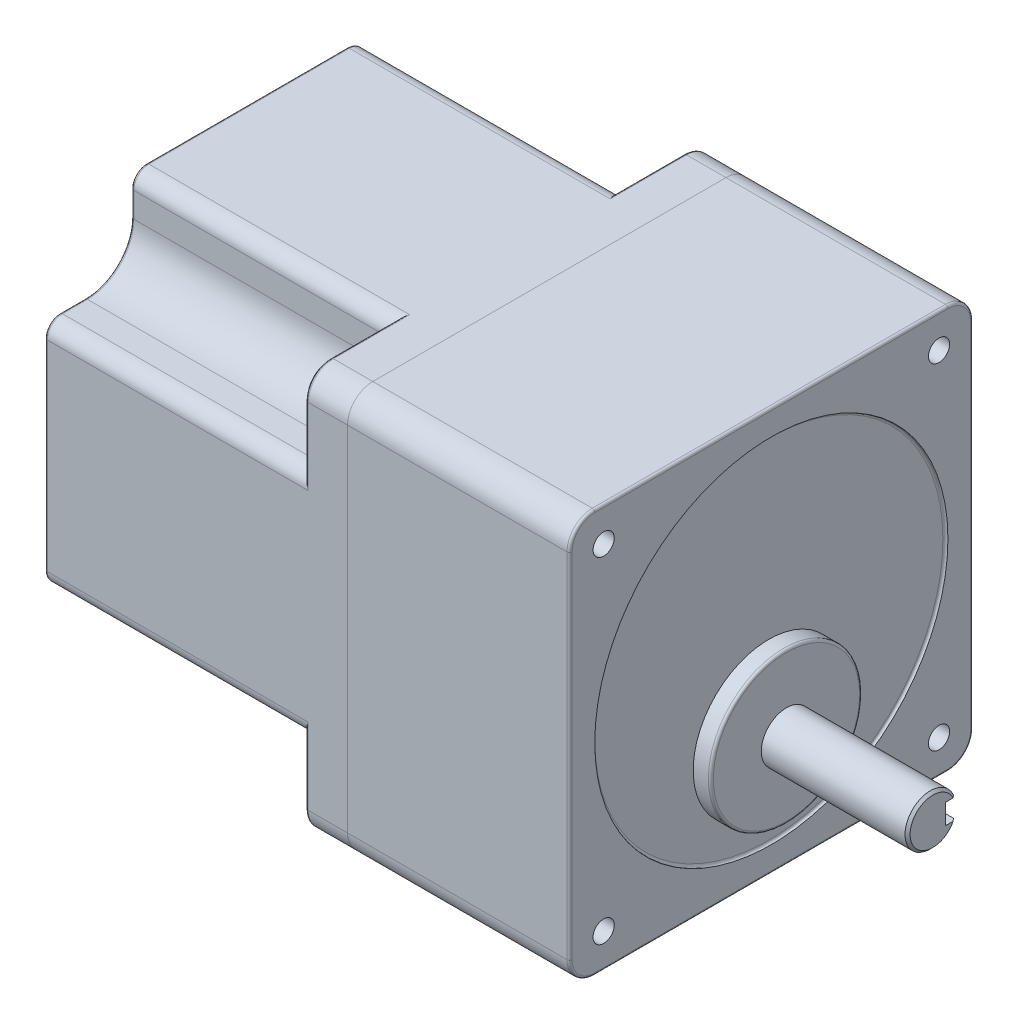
SolidWorks part; units mm, degrees
ref_plane "前视基准面" through (0, 0, 0) normal (0, 0, 1) x (1, 0, 0)
ref_plane "上视基准面" through (0, 0, 0) normal (0, 1, 0) x (1, 0, 0)
ref_plane "右视基准面" through (0, 0, 0) normal (1, 0, 0) x (0, 0, -1)
sketch "草图1" plane through (0, 0, 0) normal (1, 0, 0) x (0, 0, -1)
  line L1 (-35, -40) -> (35, -40)
  line L2 (-40, -35) -> (-40, 35)
  line L3 (-35, 40) -> (35, 40)
  line L4 (40, -35) -> (40, 35)
  line L5 (-40, -40) -> (40, 40) construction
  line L6 (-40, 40) -> (40, -40) construction
  arc A0 (35, 40) -> (40, 35) centre (35, 35) cw
  arc A1 (35, -40) -> (40, -35) centre (35, -35) ccw
  arc A2 (-35, -40) -> (-40, -35) centre (-35, -35) cw
  arc A3 (-40, 35) -> (-35, 40) centre (-35, 35) cw
  point P0 (0, 0)
  dimension "D1" = 5
extrude "凸台-拉伸1" add sketch "草图1" against normal blind 44
sketch "草图2" plane through (-44, 0, 0) normal (-1, 0, 0) x (0, 0, 1)
  line L0 (-35, 40) -> (35, 40) construction
  line L1 (-35, -40) -> (35, -40)
  line L2 (-40, -35) -> (-40, 35)
  line L3 (-35, 40) -> (35, 40)
  line L4 (40, -35) -> (40, 35)
  line L5 (-40, -40) -> (40, 40) construction
  line L6 (-40, 40) -> (40, -40) construction
  arc A0 (35, 40) -> (40, 35) centre (35, 35) cw
  arc A1 (35, -40) -> (40, -35) centre (35, -35) ccw
  arc A2 (-35, -40) -> (-40, -35) centre (-35, -35) cw
  arc A3 (-40, 35) -> (-35, 40) centre (-35, 35) cw
  point P0 (0, 0)
  dimension "D1" = 5
extrude "凸台-拉伸2" add sketch "草图2" along normal blind 60 separate body
sketch "草图3" plane through (-104, 0, 0) normal (-1, 0, 0) x (0, 0, 1)
  line L0 (-32.0461, 22.8686) -> (-37, 22.8686)
  line L1 (-40, 35) -> (-40, -35) construction
  line L3 (-32.0461, -22.8686) -> (-37, -22.8686)
  line L5 (-22.8686, -32.0461) -> (-22.8686, -37)
  line L6 (-35, -40) -> (35, -40) construction
  line L8 (22.8686, -32.0461) -> (22.8686, -37)
  line L10 (32.0461, -22.8686) -> (37, -22.8686)
  line L11 (40, -35) -> (40, 35) construction
  line L12 (-40, 19.8686) -> (-40, 35)
  line L13 (32.0461, 22.8686) -> (37, 22.8686)
  line L14 (-35, 40) -> (-19.8686, 40)
  line L15 (22.8686, 32.0461) -> (22.8686, 37)
  line L16 (35, 40) -> (-35, 40) construction
  line L17 (19.8686, 40) -> (35, 40)
  line L18 (-22.8686, 32.0461) -> (-22.8686, 37)
  line L19 (40, 35) -> (40, 19.8686)
  line L20 (40, -19.8686) -> (40, -35)
  line L21 (35, -40) -> (19.8686, -40)
  line L22 (-19.8686, -40) -> (-35, -40)
  line L23 (-40, -35) -> (-40, -19.8686)
  arc A0 (22.8686, 37) -> (19.8686, 40) centre (19.8686, 37) ccw
  arc A1 (37, 22.8686) -> (40, 19.8686) centre (37, 19.8686) cw
  arc A2 (37, -22.8686) -> (40, -19.8686) centre (37, -19.8686) ccw
  arc A3 (22.8686, -37) -> (19.8686, -40) centre (19.8686, -37) cw
  arc A4 (-22.8686, -32.0461) -> (-32.0461, -22.8686) centre (-32.0461, -32.0461) ccw
  arc A5 (32.0461, -22.8686) -> (22.8686, -32.0461) centre (32.0461, -32.0461) ccw
  arc A6 (22.8686, 32.0461) -> (32.0461, 22.8686) centre (32.0461, 32.0461) ccw
  arc A7 (-32.0461, 22.8686) -> (-22.8686, 32.0461) centre (-32.0461, 32.0461) ccw
  arc A8 (-40, -35) -> (-35, -40) centre (-35, -35) ccw
  arc A9 (-35, 40) -> (-40, 35) centre (-35, 35) ccw
  arc A10 (40, 35) -> (35, 40) centre (35, 35) ccw
  arc A11 (35, -40) -> (40, -35) centre (35, -35) ccw
  arc A12 (-22.8686, -37) -> (-19.8686, -40) centre (-19.8686, -37) ccw
  arc A13 (-37, -22.8686) -> (-40, -19.8686) centre (-37, -19.8686) cw
  arc A14 (-37, 22.8686) -> (-40, 19.8686) centre (-37, 19.8686) ccw
  arc A15 (-22.8686, 37) -> (-19.8686, 40) centre (-19.8686, 37) cw
  point P2 (0, 0)
  point P35 (22.8686, 40)
  point P54 (40, 22.8686)
  point P57 (40, -22.8686)
  point P60 (22.8686, -40)
  point P63 (-22.8686, -40)
  point P66 (-40, -22.8686)
  point P69 (-40, 22.8686)
  point P72 (-22.8686, 40)
  dimension "D1" = 3
extrude "切除-拉伸2" cut sketch "草图3" against normal blind 51.7
sketch "草图4" plane through (0, 0, 0) normal (1, 0, 0) x (0, 0, -1)
  circle A0 centre (0, 0) radius 35
extrude "切除-拉伸3" cut sketch "草图4" against normal blind 0.5
fillet "圆角1" radius 0.5 1 edges at (-0.5, 0, -35)
sketch "草图5" plane through (-0.5, 0, 0) normal (1, 0, 0) x (0, 0, -1)
  circle A0 centre (0, -15) radius 15
extrude "凸台-拉伸3" add sketch "草图5" along normal blind 3.5
fillet "圆角2" radius 0.5 1 edges at (3, -15, -15)
fillet "圆角3" radius 0.5 8 edges at (0, -38.5355, 38.5355) (0, -40, 0) (0, -38.5355, -38.5355) (0, 38.5355, -38.5355) (0, 40, 0) (0, 38.5355, 38.5355) (0, 0, 40) (0, 0, -40)
fillet "圆角4" radius 0.5 24 edges at (-104, 25.5566, 25.5566) (-104, 22.8686, 34.523) (-104, 21.9899, 39.1213) (-104, 0, 40) (-104, -21.9899, 39.1213) (-104, -22.8686, 34.523) (-104, -25.5566, 25.5566) (-104, -34.523, 22.8686) (-104, -39.1213, 21.9899) (-104, -40, 0) (-104, -39.1213, -21.9899) (-104, -34.523, -22.8686) (-104, -25.5566, -25.5566) (-104, -22.8686, -34.523) (-104, -21.9899, -39.1213) (-104, 0, -40) (-104, 21.9899, -39.1213) (-104, 22.8686, -34.523) (-104, 25.5566, -25.5566) (-104, 34.523, -22.8686) (-104, 39.1213, -21.9899) (-104, 40, 0) (-104, 39.1213, 21.9899) (-104, 34.523, 22.8686)
sketch "草图6" plane through (3, 0, 0) normal (1, 0, 0) x (0, 0, -1)
  circle A0 centre (0, -15) radius 5
extrude "凸台-拉伸4" add sketch "草图6" along normal blind 29
ref_plane "基准面1" through (0, 0, -5) normal (0, 0, 1) x (1, 0, 0)
sketch "草图7" plane through (0, 0, -5) normal (0, 0, 1) x (1, 0, 0)
  line L1 (32, -20) -> (32, -10) construction
  line L2 (32, -13) -> (9, -13)
  line L3 (32, -13) -> (32, -17)
  line L4 (32, -17) -> (9, -17)
  arc A0 (9, -13) -> (9, -17) centre (9, -15) ccw
extrude "切除-拉伸5" cut sketch "草图7" along normal blind 2.5
chamfer "倒角1" distance 0.5 angle 45 1 edges at (32, -15, 5)
sketch "草图9" plane through (0, 0, 0) normal (1, 0, 0) x (0, 0, -1)
  point P19 (-33.234, 33.234)
  point P20 (33.234, 33.234)
  point P21 (33.234, -33.234)
  point P22 (-33.234, -33.234)
hole_wizard "M5 螺纹孔1" positions "3D草图1" profile "草图10" tap size "M5" standard "GB"
sketch3d "3D草图1"
  point P0 (0, 33.234, 33.234)
  point P3 (0, 33.234, -33.234)
  point P6 (0, -33.234, -33.234)
  point P9 (0, -33.234, 33.234)
sketch "草图10" plane through (0, 33.234, 33.234) normal (0, 1, 0) x (0, 0, -1)
  line L0 (0, 0) -> (0, 15.2618)
  line L1 (0, 15.2618) -> (2.1, 14)
  line L2 (2.1, 14) -> (2.1, 0)
  line L5 (2.1, 0) -> (0, 0)
  line L10 (0, 15.2618) -> (-2.1, 14) construction
  line L11 (0, -6.35) -> (0, 107.95) construction
  dimension "螺纹孔钻头直径" = 4.2
  dimension "螺纹孔钻头深度" = 14
  dimension "导头角度" = 118
sketch "草图11" plane through (-52.3, 0, 0) normal (-1, 0, 0) x (0, 0, 1)
  circle A0 centre (-32.0461, 32.0461) radius 4
  circle A1 centre (32.0461, 32.0461) radius 4
  circle A2 centre (32.0461, -32.0461) radius 4
  circle A3 centre (-32.0461, -32.0461) radius 4
extrude "凸台-拉伸5" add sketch "草图11" along normal blind 3.5 separate body
sketch "草图12" plane through (-55.8, 0, 0) normal (-1, 0, 0) x (0, 0, 1)
  line L1 (-30.7774, 34.2778) -> (-33.3444, 34.2607)
  line L2 (-33.3444, 34.2607) -> (-34.6132, 32.029)
  line L3 (-34.6132, 32.029) -> (-33.3148, 29.8144)
  line L4 (-33.3148, 29.8144) -> (-30.7477, 29.8315)
  line L5 (-30.7477, 29.8315) -> (-29.479, 32.0632)
  line L6 (-29.479, 32.0632) -> (-30.7774, 34.2778)
  line L7 (33.2714, 34.2778) -> (30.726, 34.2231)
  line L8 (30.726, 34.2231) -> (29.5007, 31.9914)
  line L9 (29.5007, 31.9914) -> (30.8208, 29.8144)
  line L10 (30.8208, 29.8144) -> (33.3661, 29.8691)
  line L11 (33.3661, 29.8691) -> (34.5915, 32.1008)
  line L12 (34.5915, 32.1008) -> (33.2714, 34.2778)
  line L13 (-30.7477, -29.7159) -> (-33.4149, -29.7566)
  line L14 (-33.4149, -29.7566) -> (-34.7132, -32.0868)
  line L15 (-34.7132, -32.0868) -> (-33.3444, -34.3762)
  line L16 (-33.3444, -34.3762) -> (-30.6773, -34.3356)
  line L17 (-30.6773, -34.3356) -> (-29.379, -32.0054)
  line L18 (-29.379, -32.0054) -> (-30.7477, -29.7159)
  line L19 (30.6027, -34.5461) -> (33.4895, -34.5461)
  line L20 (33.4895, -34.5461) -> (34.9328, -32.0461)
  line L21 (34.9328, -32.0461) -> (33.4895, -29.5461)
  line L22 (33.4895, -29.5461) -> (30.6027, -29.5461)
  line L23 (30.6027, -29.5461) -> (29.1593, -32.0461)
  line L24 (29.1593, -32.0461) -> (30.6027, -34.5461)
  circle A0 centre (-32.0461, 32.0461) radius 2.2232 construction
  circle A1 centre (32.0461, 32.0461) radius 2.2049 construction
  circle A2 centre (-32.0461, -32.0461) radius 2.3101 construction
  circle A3 centre (32.0461, -32.0461) radius 2.5 construction
extrude "切除-拉伸6" cut sketch "草图12" against normal blind 1.5
chamfer "倒角2" distance 0.3 angle 45 6 edges at (-55.8, 30.9217, -33.964) (-55.8, 29.8229, -32.0313) (-55.8, 30.9473, -30.1134) (-55.8, 33.1705, -30.1282) (-55.8, 33.1448, -33.9788) (-55.8, 34.2692, -32.0609)
chamfer "倒角3" distance 0.3 angle 45 6 edges at (-55.8, 33.1893, 33.9314) (-55.8, 30.9849, 33.9788) (-55.8, 29.8417, 32.0934) (-55.8, 30.9029, 30.1607) (-55.8, 33.1072, 30.1134) (-55.8, 34.2504, 31.9987)
chamfer "倒角4" distance 0.3 angle 45 6 edges at (-55.8, -30.7961, 34.2112) (-55.8, -33.2961, 34.2112) (-55.8, -34.5461, 32.0461) (-55.8, -33.2961, 29.881) (-55.8, -30.7961, 29.881) (-55.8, -29.5461, 32.0461)
chamfer "倒角5" distance 0.3 angle 45 6 edges at (-55.8, -30.8607, -30.0633) (-55.8, -33.1705, -30.0281) (-55.8, -34.3559, -32.0109) (-55.8, -33.2315, -34.0288) (-55.8, -30.9217, -34.064) (-55.8, -29.7363, -32.0813)
fillet "圆角6" radius 0.5 12 edges at (-52.3, 40, -27.4343) (-52.3, 38.5355, -38.5355) (-52.3, 27.4343, -40) (-52.3, -27.4343, -40) (-52.3, -38.5355, -38.5355) (-52.3, -40, -27.4343) (-52.3, -40, 27.4343) (-52.3, -38.5355, 38.5355) (-52.3, -27.4343, 40) (-52.3, 40, 27.4343) (-52.3, 38.5355, 38.5355) (-52.3, 27.4343, 40)
